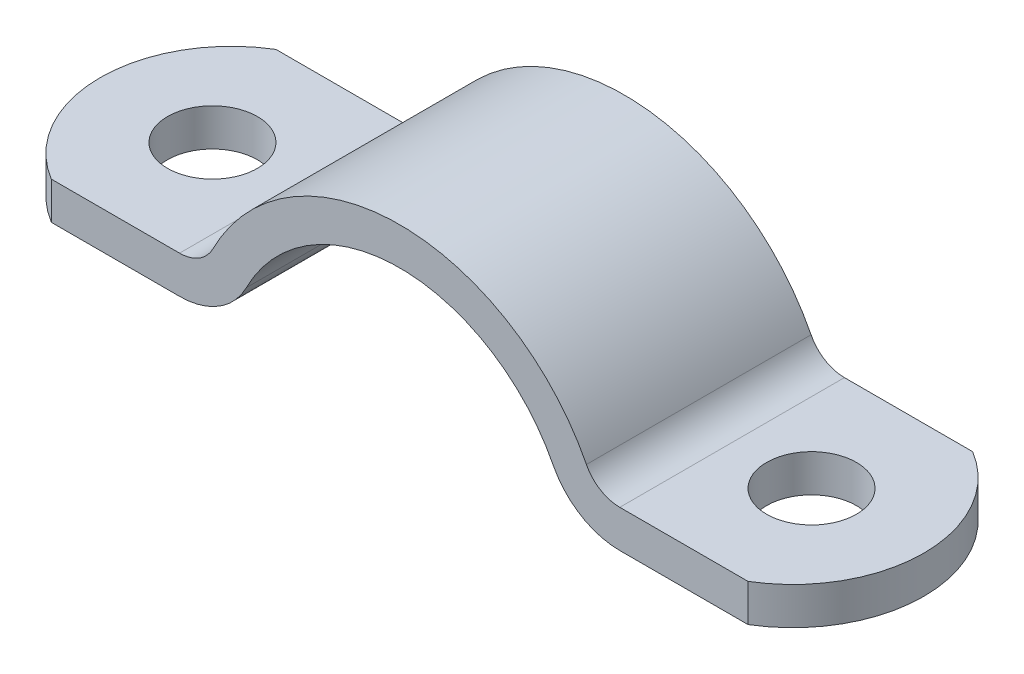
SolidWorks part; units mm, degrees
ref_plane "Plan_Face" through (0, 0, 0) normal (0, 0, 1) x (1, 0, 0)
ref_plane "Plan_Dessus" through (0, 0, 0) normal (0, 1, 0) x (1, 0, 0)
ref_plane "Plan_Droite" through (0, 0, 0) normal (1, 0, 0) x (0, 0, -1)
sketch "Esquisse1" plane through (0, 0, 0) normal (0, 0, 1) x (1, 0, 0)
  line L0 (22.4499, 0) -> (60, 0)
  line L1 (60, 0) -> (60, 5)
  line L2 (60, 5) -> (26.1534, 5)
  line L3 (0, 51.2602) -> (0, -60.7104) construction
  line L4 (-60, 0) -> (-60, 5)
  line L5 (-22.4499, 0) -> (-60, 0)
  line L6 (-60, 5) -> (-26.1534, 5)
  arc A0 (22.4499, 0) -> (-22.4499, 0) centre (0, -5) ccw
  arc A1 (26.1534, 5) -> (-26.1534, 5) centre (0, -5) ccw
  dimension "D1" = 46
  dimension "D2" = 5
  dimension "D3" = 5
  dimension "D4" = 5
  dimension "D5" = 120
extrude "Extrusion1" add sketch "Esquisse1" along normal mid plane 30
fillet "Congé1" radius 10 2 edges at (22.4499, 0, 0) (-22.4499, 0, 0)
fillet "Congé2" radius 5 2 edges at (26.1534, 5, 0) (-26.1534, 5, 0)
sketch "Esquisse2" plane through (0, 0, 0) normal (0, -1, 0) x (1, 0, 0)
  line L2 (-46.5139, 15) -> (-60, 15)
  line L3 (-60, 15) -> (-29.3939, 15) construction
  line L4 (-60, 0) -> (-60, -15)
  line L5 (-60, -15) -> (-46.5139, -15)
  line L6 (-60, -15) -> (-29.3939, -15) construction
  line L7 (60, 15) -> (46.5139, 15)
  line L8 (-37.5, 0) -> (37.5, 0)
  line L10 (29.3939, 15) -> (60, 15) construction
  line L11 (60, 15) -> (60, 0)
  line L12 (60, 0) -> (60, -15)
  line L13 (60, -15) -> (46.5139, -15)
  line L15 (29.3939, -15) -> (60, -15) construction
  line L16 (-60, 0) -> (-60, 15)
  arc A0 (-46.5139, 15) -> (-46.5139, -15) centre (-37.5, 0) ccw
  arc A1 (46.5139, -15) -> (46.5139, 15) centre (37.5, 0) ccw
  dimension "D1" = 35
  dimension "D2" = 75
extrude "Extrusion2" cut sketch "Esquisse2" against normal through all contours A0 L2 L16 L4 L5 | A1 M3 M4 M1
sketch "Esquisse3" plane through (0, 5, 0) normal (0, 1, 0) x (1, 0, 0)
  line L0 (-40, 0) -> (40, 0) construction
  circle A0 centre (-40, 0) radius 6
  circle A1 centre (40, 0) radius 6
  dimension "D1" = 12
  dimension "D2" = 80
extrude "Extrusion3" cut sketch "Esquisse3" against normal through all
